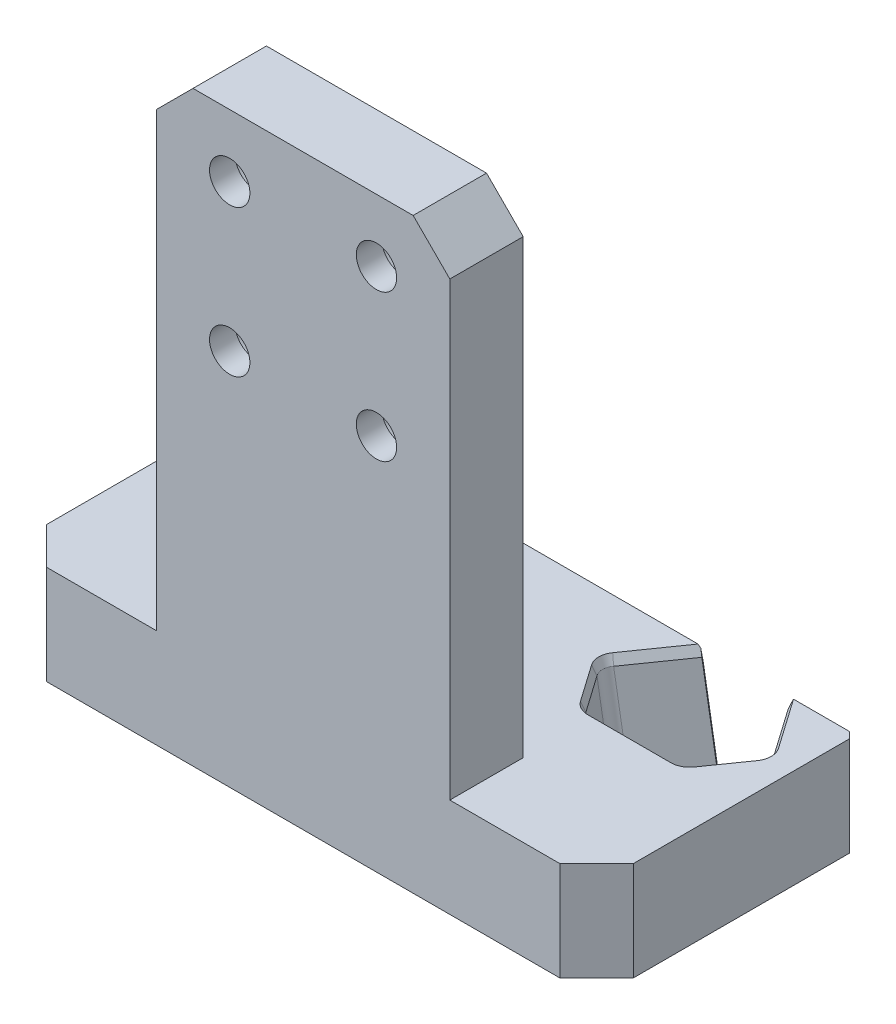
SolidWorks part; units mm, degrees
ref_plane "Спереди" through (0, 0, 0) normal (0, 0, 1) x (1, 0, 0)
ref_plane "Сверху" through (0, 0, 0) normal (0, 1, 0) x (1, 0, 0)
ref_plane "Справа" through (0, 0, 0) normal (1, 0, 0) x (0, 0, -1)
sketch "Эскиз1" plane through (0, 0, 0) normal (1, 0, 0) x (0, 0, -1)
  line L0 (0, 0) -> (72, 0)
  line L1 (72, 0) -> (72, 27)
  line L2 (72, 27) -> (20, 27)
  line L3 (20, 27) -> (20, 160)
  line L4 (20, 160) -> (0, 160)
  line L5 (0, 160) -> (0, 0)
  dimension "D1" = 72
  dimension "D2" = 160
  dimension "D3" = 20
  dimension "D4" = 27
extrude "Бобышка-Вытянуть1" add sketch "Эскиз1" along normal blind 160
sketch "Эскиз2" plane through (0, 0, -20) normal (0, 0, -1) x (-1, 0, 0)
  line L0 (-160, 160) -> (-120, 160)
  line L1 (-160, 160) -> (0, 160) construction
  line L2 (-120, 160) -> (-120, 27)
  line L3 (-160, 27) -> (0, 27) construction
  line L4 (-120, 27) -> (-160, 27)
  line L5 (-160, 27) -> (-160, 160)
  line L6 (-40, 160) -> (0, 160)
  line L7 (0, 160) -> (0, 27)
  line L8 (0, 27) -> (-40, 27)
  line L9 (-40, 27) -> (-40, 160)
  dimension "D1" = 40
  dimension "D2" = 40
extrude "Вырез-Вытянуть1" cut sketch "Эскиз2" against normal blind 30
sketch "Эскиз3" plane through (0, 0, -20) normal (0, 0, -1) x (-1, 0, 0)
  line L0 (-120, 160) -> (-40, 160) construction
  line L1 (-40, 160) -> (-40, 27) construction
  circle A0 centre (-100, 143) radius 9
  circle A1 centre (-60, 143) radius 9
  circle A2 centre (-100, 103) radius 9
  circle A3 centre (-60, 103) radius 9
  dimension "D1" = 18
  dimension "D2" = 18
  dimension "D3" = 18
  dimension "D4" = 18
  dimension "D5" = 40
  dimension "D6" = 40
  dimension "D7" = 17
  dimension "D8" = 17
  dimension "D9" = 40
  dimension "D10" = 40
  dimension "D11" = 20
  dimension "D12" = 20
extrude "Вырез-Вытянуть2" cut sketch "Эскиз3" against normal blind 13
sketch "Эскиз4" plane through (0, 0, -7) normal (0, 0, -1) x (-1, 0, 0)
  circle A0 centre (-100, 143) radius 5.5
  circle A1 centre (-100, 143) radius 9 construction
  dimension "D1" = 11
extrude "Вырез-Вытянуть3" cut sketch "Эскиз4" against normal blind 13
sketch "Эскиз5" plane through (0, 0, -7) normal (0, 0, -1) x (-1, 0, 0)
  circle A0 centre (-60, 143) radius 5.5
  circle A1 centre (-60, 143) radius 9 construction
  dimension "D1" = 11
extrude "Вырез-Вытянуть4" cut sketch "Эскиз5" against normal blind 13
sketch "Эскиз6" plane through (0, 0, -7) normal (0, 0, -1) x (-1, 0, 0)
  circle A0 centre (-100, 103) radius 5.5
  circle A1 centre (-100, 103) radius 9 construction
  dimension "D1" = 11
extrude "Вырез-Вытянуть5" cut sketch "Эскиз6" against normal blind 13
sketch "Эскиз7" plane through (0, 0, -7) normal (0, 0, -1) x (-1, 0, 0)
  circle A0 centre (-60, 103) radius 5.5
  circle A1 centre (-60, 103) radius 9 construction
  dimension "D1" = 11
extrude "Вырез-Вытянуть6" cut sketch "Эскиз7" against normal blind 13
chamfer "Фаска1" distance 10 angle 45 2 edges at (40, 160, -10) (120, 160, -10)
chamfer "Фаска2" distance 10 angle 45 2 edges at (160, 13.5, 0) (0, 13.5, 0)
chamfer "Фаска3" distance 3 angle 45 2 edges at (160, 13.5, -72) (0, 13.5, -72)
sketch "Эскиз9" plane through (0, 27, 0) normal (0, 1, 0) x (1, 0, 0)
  line L0 (80, 89.3069) -> (80, 31.3889) construction
  line L1 (157, 72) -> (3, 72) construction
  line L2 (18.78, 72) -> (41.22, 72)
  line L3 (41.22, 72) -> (53.7483, 54.1077)
  line L4 (53.7483, 54.1077) -> (43.87, 40)
  line L5 (43.87, 40) -> (16.13, 40)
  line L6 (16.13, 40) -> (6.2517, 54.1077)
  line L7 (6.2517, 54.1077) -> (18.78, 72)
  line L8 (0, 69) -> (0, 10) construction
  line L9 (153.7483, 54.1077) -> (141.22, 72)
  line L10 (143.87, 40) -> (153.7483, 54.1077)
  line L11 (116.13, 40) -> (143.87, 40)
  line L12 (106.2517, 54.1077) -> (116.13, 40)
  line L13 (118.78, 72) -> (106.2517, 54.1077)
  line L14 (141.22, 72) -> (118.78, 72)
  point P4 (80, 72)
  point P7 (30, 72)
  dimension "D1" = 27.74
  dimension "D2" = 22.44
  dimension "D3" = 70
  dimension "D4" = 70
  dimension "D5" = 30
  dimension "D6" = 32
extrude "Вырез-Вытянуть8" cut sketch "Эскиз9" against normal through all
draft "Уклон8" type of draft neutral plane draft angle 8 faces to draft 2 parameters "D1"=8
draft "Уклон9" type of draft neutral plane draft angle 8 faces to draft 2 parameters "D1"=8
draft "Уклон10" type of draft neutral plane draft angle 8 faces to draft 2 parameters "D1"=8
draft "Уклон11" type of draft neutral plane draft angle 8 faces to draft 2 parameters "D1"=8
chamfer "Фаска5" distance 5 angle 15 3 edges at (10.89, 27, -72) (149.11, 27, -72) (80, 27, -72)
fillet "Скругление1" radius 4 1 edges at (151.4321, 13.5, -54.1077)
fillet "Скругление2" radius 4 7 edges at (8.5679, 13.5, -54.1077) (18.4462, 13.5, -40) (41.5538, 13.5, -40) (51.4321, 13.5, -54.1077) (108.5679, 13.5, -54.1077) (118.4462, 13.5, -40) (141.5538, 13.5, -40)
chamfer "Фаска6" distance 2.5 angle 45 4 edges at (21.5251, 11, -72) (121.5251, 11, -72) (38.4749, 11, -72) (138.4749, 11, -72)
chamfer "Фаска8" distance 2.5 angle 15 9 edges at (12.7934, 27, -63.4503) (7.1243, 27, -54.1077) (11.3813, 27, -46.7819) (16.3741, 27, -40.4583) (30, 27, -40) (47.4091, 27, -63.1611) (43.6259, 27, -40.4583) (52.8757, 27, -54.1077) (48.6187, 27, -46.7819)
chamfer "Фаска9" distance 2.5 angle 15 9 edges at (112.7934, 27, -63.4503) (107.1243, 27, -54.1077) (111.3813, 27, -46.7819) (116.3741, 27, -40.4583) (130, 27, -40) (147.4091, 27, -63.1611) (143.6259, 27, -40.4583) (152.8757, 27, -54.1077) (148.6187, 27, -46.7819)
draft "Уклон12" type of draft neutral plane draft angle 8 faces to draft 1 parameters "D1"=8
